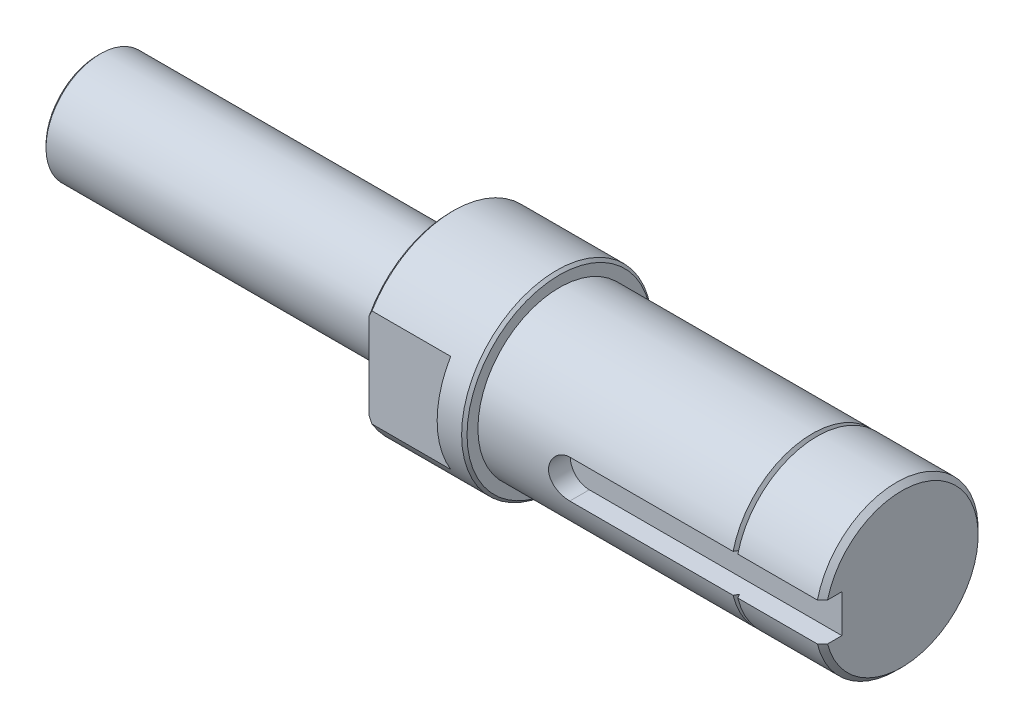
SolidWorks part; units mm, degrees
ref_plane "Front X-Y" through (0, 0, 0) normal (0, 0, 1) x (1, 0, 0)
ref_plane "Top X-Z" through (0, 0, 0) normal (0, 1, 0) x (1, 0, 0)
ref_plane "Right Y-Z" through (0, 0, 0) normal (1, 0, 0) x (0, 0, -1)
ref_plane "Plane1" through (0, 0, 0) normal (0, 0, 1) x (1, 0, 0)
sketch "Sketch1" plane through (0, 0, 0) normal (0, 0, 1) x (1, 0, 0)
  line L0 (-65, 0) -> (-65, 9.5)
  line L1 (-65, 9.5) -> (-64.5, 10)
  line L2 (-64.5, 10) -> (0, 10)
  line L3 (0, 10) -> (0, 17)
  line L4 (0, 17) -> (0.5, 17.5)
  line L5 (0.5, 17.5) -> (19.5, 17.5)
  line L6 (19.5, 17.5) -> (20, 17)
  line L7 (20, 17) -> (20, 15)
  line L8 (20, 15) -> (82.08, 15)
  line L9 (82.08, 15) -> (83, 14.08)
  line L10 (83, 14.08) -> (83, 0)
  line L11 (83, 0) -> (-65, 0)
  line L12 (83, 0) -> (-65, 0) construction
revolve "Revolve1" add sketch "Sketch1" angle 360 about L12
ref_plane "Plane2" through (0, 0, 15) normal (0, 0, 1) x (1, 0, 0)
sketch "Sketch2" plane through (0, 0, 15) normal (0, 0, 1) x (1, 0, 0)
  line L0 (36.5, -3.5) -> (83, -3.5)
  line L1 (83, -3.5) -> (83, 3.5)
  line L2 (83, 3.5) -> (36.5, 3.5)
  arc A0 (36.5, 3.5) -> (36.5, -3.5) centre (36.5, 0) ccw
extrude "Cut-Extrude1" cut sketch "Sketch2" against normal blind 4
ref_plane "Plane3" through (0, 0, 0) normal (1, 0, 0) x (0, 0, -1)
sketch "Sketch3" plane through (0, 0, 0) normal (1, 0, 0) x (0, 0, -1)
  line L0 (-30, -35) -> (-15, -35)
  line L1 (-15, -35) -> (-15, 35)
  line L2 (-15, 35) -> (15, 35)
  line L3 (15, 35) -> (15, -35)
  line L4 (15, -35) -> (30, -35)
  line L5 (30, -35) -> (30, 37)
  line L6 (30, 37) -> (-30, 37)
  line L7 (-30, 37) -> (-30, -35)
extrude "Cut-Extrude2" cut sketch "Sketch3" along normal blind 15
sketch "Sketch5" plane through (0, 0, 0) normal (0, 0, 1) x (1, 0, 0)
  line L0 (0, 0) -> (99.0445, 0) construction
  line L1 (66.567, 15) -> (67, 14.25)
  line L2 (67, 14.25) -> (67.433, 15)
  line L3 (67.433, 15) -> (66.567, 15)
  line L4 (83, -14.08) -> (83, 14.08) construction
  line L5 (82.08, 15) -> (20, 15) construction
  dimension "D1" = 60
  dimension "D2" = 16
  dimension "D3" = 0.75
revolve "Cut-Revolve1" cut sketch "Sketch5" angle 360 about L0
